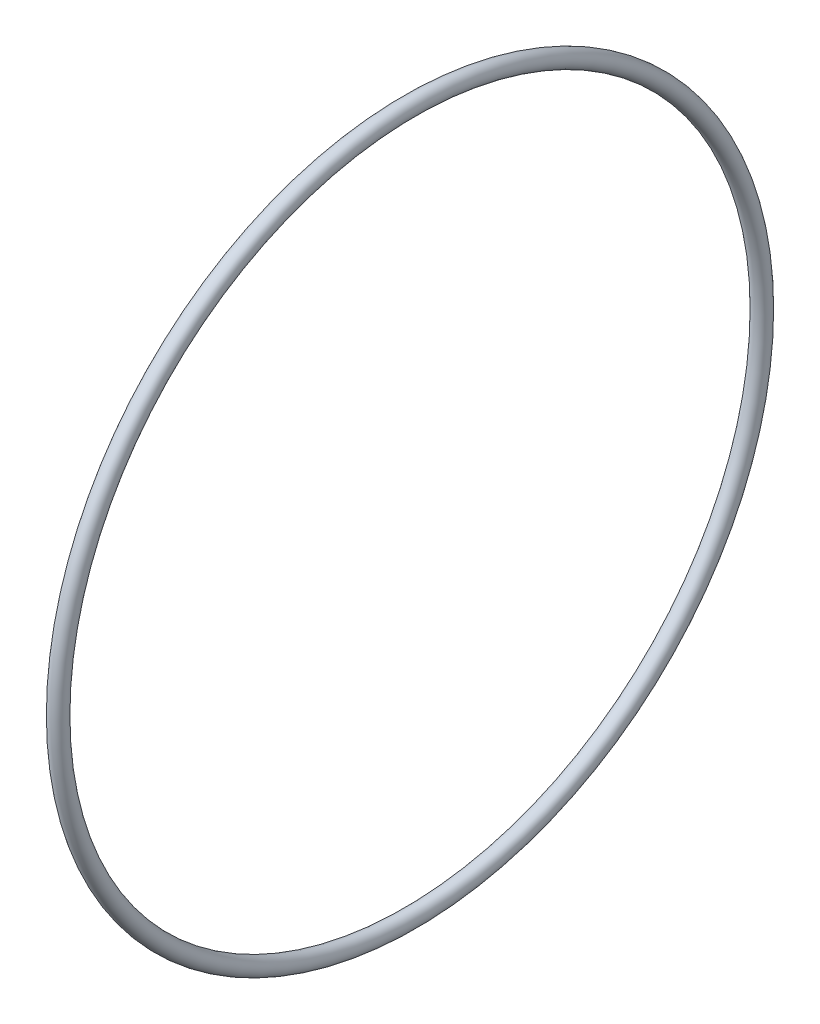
SolidWorks part; units mm, degrees
ref_plane "Plane1" through (0, 0, 0) normal (0, 0, 1) x (1, 0, 0)
ref_plane "Plane2" through (0, 0, 0) normal (0, 1, 0) x (1, 0, 0)
ref_plane "Plane3" through (0, 0, 0) normal (1, 0, 0) x (0, 0, -1)
sketch "Sketch1" plane through (0, 0, 0) normal (0, 0, 1) x (1, 0, 0)
  line L3 (0, 0) -> (12.9063, 0) construction
  circle A0 centre (0, 55.118) radius 1.304
  dimension "D1" = 2.6081
  dimension "D3" = 55.118
revolve "Base-Revolve" add sketch "Sketch1" angle 360 about L3
